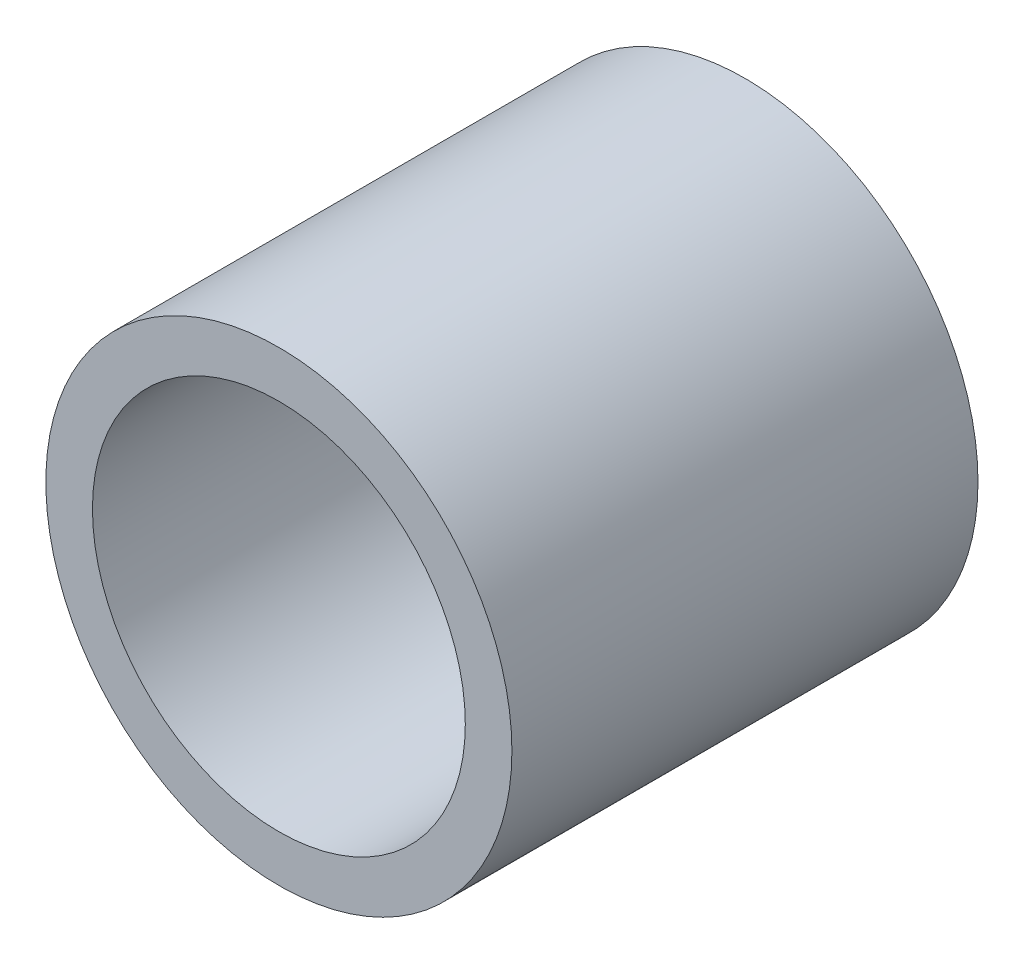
SolidWorks part; units mm, degrees
ref_plane "Front Plane" through (0, 0, 0) normal (0, 0, 1) x (1, 0, 0)
ref_plane "Top Plane" through (0, 0, 0) normal (0, 1, 0) x (1, 0, 0)
ref_plane "Right Plane" through (0, 0, 0) normal (1, 0, 0) x (0, 0, -1)
sketch "Sketch1" plane through (0, 0, 0) normal (0, 0, 1) x (1, 0, 0)
  circle A0 centre (0, 0) radius 20
  circle A1 centre (0, 0) radius 16
extrude "Extrude1" add sketch "Sketch1" along normal blind 40
